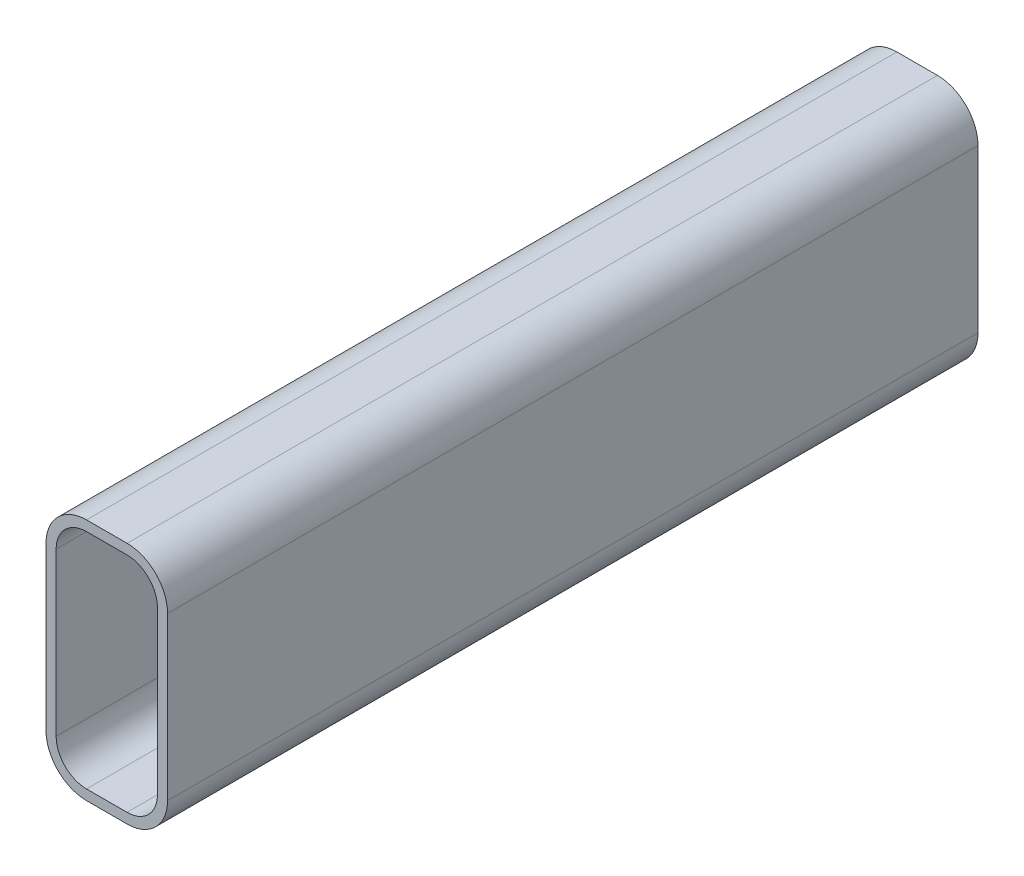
SolidWorks part; units mm, degrees
ref_plane "Front" through (0, 0, 0) normal (0, 0, 1) x (1, 0, 0)
ref_plane "Top" through (0, 0, 0) normal (0, 1, 0) x (1, 0, 0)
ref_plane "Right" through (0, 0, 0) normal (1, 0, 0) x (0, 0, -1)
sketch "Sketch1" plane through (0, 0, 0) normal (0, 0, 1) x (1, 0, 0)
  line L0 (-6.35, 38.1) -> (6.35, 38.1)
  line L1 (-19.05, 25.4) -> (-19.05, -25.4)
  line L2 (6.35, -38.1) -> (-6.35, -38.1)
  line L3 (19.05, -25.4) -> (19.05, 25.4)
  line L4 (0, 38.1) -> (0, -38.1) construction
  arc A0 (19.05, 25.4) -> (6.35, 38.1) centre (6.35, 25.4) ccw
  arc A1 (19.05, -25.4) -> (6.35, -38.1) centre (6.35, -25.4) cw
  arc A2 (-6.35, -38.1) -> (-19.05, -25.4) centre (-6.35, -25.4) cw
  arc A3 (-19.05, 25.4) -> (-6.35, 38.1) centre (-6.35, 25.4) cw
  dimension "D1" = 12.7
  dimension "D2" = 76.2
  dimension "D3" = 38.1
extrude "Base-Extrude-Thin" add sketch "Sketch1" along normal blind 254 thin
